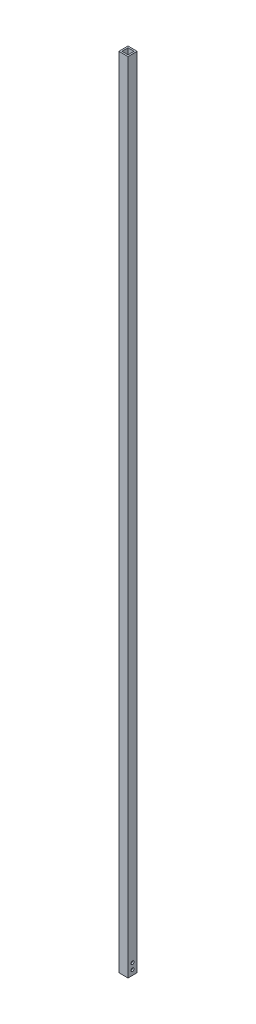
SolidWorks part; units mm, degrees
ref_plane "Front Plane" through (0, 0, 0) normal (0, 0, 1) x (1, 0, 0)
ref_plane "Top Plane" through (0, 0, 0) normal (0, 1, 0) x (1, 0, 0)
ref_plane "Right Plane" through (0, 0, 0) normal (1, 0, 0) x (0, 0, -1)
sketch "Sketch3" plane through (0, 0, 0) normal (0, 1, 0) x (1, 0, 0)
  line L0 (-3.175, -3.175) -> (-3.175, 3.175)
  line L1 (-4.7625, -4.7625) -> (4.7625, -4.7625)
  line L2 (-4.7625, -4.7625) -> (-4.7625, 4.7625)
  line L3 (-4.7625, 4.7625) -> (4.7625, 4.7625)
  line L4 (4.7625, -4.7625) -> (4.7625, 4.7625)
  line L5 (-4.7625, -4.7625) -> (4.7625, 4.7625) construction
  line L6 (-4.7625, 4.7625) -> (4.7625, -4.7625) construction
  line L7 (-3.175, 3.175) -> (3.175, 3.175)
  line L8 (3.175, -3.175) -> (3.175, 3.175)
  line L9 (-3.175, -3.175) -> (3.175, -3.175)
  dimension "D1" = 9.525
  dimension "D2" = 9.525
  dimension "D3" = 1.5875
extrude "Boss-Extrude1" add sketch "Sketch3" along normal blind 828.802
hole_wizard "1/8 (0.125) Diameter Hole1" positions "Sketch5" profile "Sketch4" hole size "1/8" standard "ANSI Inch"
sketch "Sketch5" plane through (-4.7625, 0, 0) normal (-1, 0, 0) x (0, 0, 1)
  circle A0 centre (0, 11.43) radius 1.5875 construction
  circle A1 centre (0, 5.08) radius 1.5875 construction
  point P11 (0, 5.08)
  point P15 (0, 11.43)
sketch "Sketch4" plane through (-4.7625, 5.08, 0) normal (0, 1, 0) x (0, 0, 1)
  line L0 (0, 0) -> (0, 9.525)
  line L1 (0, 9.525) -> (1.5875, 9.525)
  line L2 (1.5875, 9.525) -> (1.5875, 0)
  line L5 (1.5875, 0) -> (0, 0)
  line L11 (0, -6.35) -> (0, 107.95) construction
  dimension "Thru Hole Dia." = 3.175
  dimension "Thru Hole Depth" = 9.525
